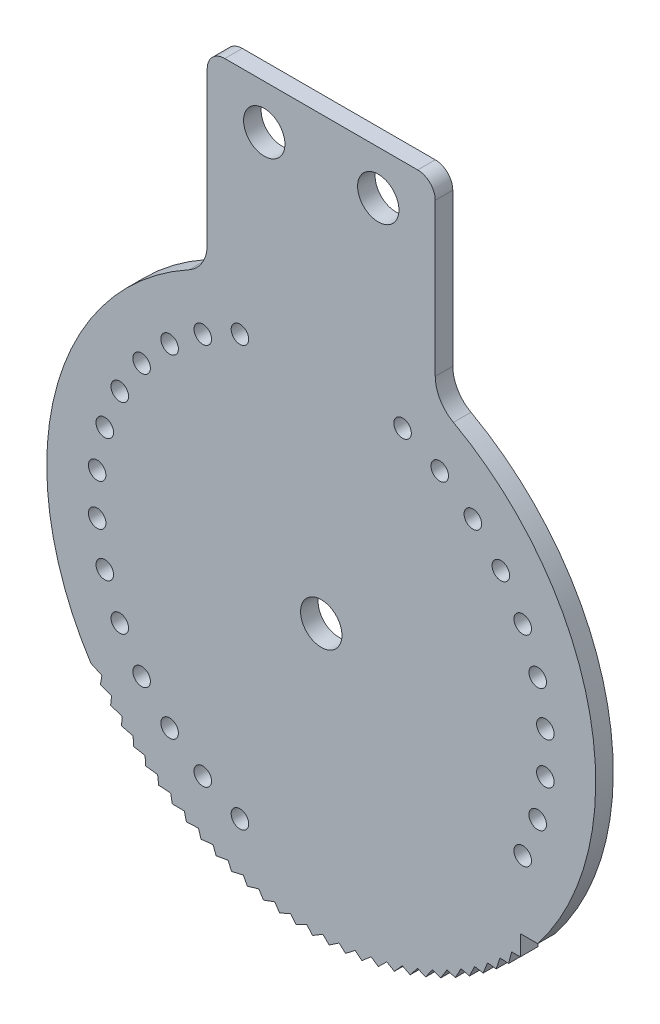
SolidWorks part; units mm, degrees
ref_plane "Front Plane" through (0, 0, 0) normal (0, 0, 1) x (1, 0, 0)
ref_plane "Top Plane" through (0, 0, 0) normal (0, 1, 0) x (1, 0, 0)
ref_plane "Right Plane" through (0, 0, 0) normal (1, 0, 0) x (0, 0, -1)
sketch "Sketch1" plane through (0, 0, 0) normal (0, 0, 1) x (1, 0, 0)
  line L0 (16.8766, 28.4861) -> (16.8766, 50.5569)
  line L1 (-13.589, 53.0969) -> (14.3366, 53.0969)
  line L2 (-21.1851, -44.1428) -> (-19.4455, -44.1554)
  line L3 (-21.1851, -44.1428) -> (-21.4191, -42.9029)
  line L4 (-23.1548, -42.7856) -> (-21.4191, -42.9029)
  line L5 (-23.1548, -42.7856) -> (-23.3139, -41.5339)
  line L6 (-25.0394, -41.3124) -> (-23.3139, -41.5339)
  line L7 (-25.0394, -41.3124) -> (-25.1229, -40.0534)
  line L8 (-26.8319, -39.7285) -> (-25.1229, -40.0534)
  line L9 (-26.8319, -39.7285) -> (-26.8395, -38.4668)
  line L10 (-28.526, -38.0397) -> (-26.8395, -38.4668)
  line L11 (-28.526, -38.0397) -> (-28.4577, -36.7797)
  line L12 (-30.1154, -36.252) -> (-28.4577, -36.7797)
  line L13 (-30.1154, -36.252) -> (-29.9714, -34.9985)
  line L14 (-31.5943, -34.372) -> (-29.9714, -34.9985)
  line L15 (-31.5943, -34.372) -> (-31.3752, -33.1294)
  line L16 (-32.9576, -32.4064) -> (-31.3752, -33.1294)
  line L17 (-19.1373, -45.379) -> (-17.4, -45.287)
  line L18 (-19.1373, -45.379) -> (-19.4455, -44.1554)
  line L19 (-17.0188, -46.4898) -> (-17.4, -45.287)
  line L20 (-17.0188, -46.4898) -> (-15.2902, -46.2935)
  line L21 (-14.8373, -47.4712) -> (-15.2902, -46.2935)
  line L22 (-14.8373, -47.4712) -> (-13.1237, -47.1713)
  line L23 (-12.6008, -48.3197) -> (-13.1237, -47.1713)
  line L24 (-12.6008, -48.3197) -> (-10.9083, -47.9172)
  line L25 (-10.3173, -49.032) -> (-10.9083, -47.9172)
  line L26 (-10.3173, -49.032) -> (-8.6521, -48.5285)
  line L27 (-7.9951, -49.6057) -> (-8.6521, -48.5285)
  line L28 (-7.9951, -49.6057) -> (-6.3632, -49.003)
  line L29 (-5.6425, -50.0387) -> (-6.3632, -49.003)
  line L30 (-5.6425, -50.0387) -> (-4.0498, -49.3389)
  line L31 (-3.2682, -50.3295) -> (-4.0498, -49.3389)
  line L32 (-3.2682, -50.3295) -> (-1.7205, -49.5351)
  line L33 (-0.8807, -50.4769) -> (-1.7205, -49.5351)
  line L34 (-0.8807, -50.4769) -> (0.6164, -49.5909)
  line L35 (1.5113, -50.4804) -> (0.6164, -49.5909)
  line L36 (1.5113, -50.4804) -> (2.9525, -49.5059)
  line L37 (3.8992, -50.34) -> (2.9525, -49.5059)
  line L38 (3.8992, -50.34) -> (5.2792, -49.2807)
  line L39 (6.2744, -50.0563) -> (5.2792, -49.2807)
  line L40 (6.2744, -50.0563) -> (7.5881, -48.9159)
  line L41 (8.6282, -49.6302) -> (7.5881, -48.9159)
  line L42 (8.6282, -49.6302) -> (9.8709, -48.4128)
  line L43 (10.9521, -49.0633) -> (9.8709, -48.4128)
  line L44 (29.1931, -38.1247) -> (27.9313, -38.1247)
  line L45 (29.1931, -38.1287) -> (29.1931, -35.2117)
  line L46 (29.1931, -35.2117) -> (31.7074, -35.2117)
  line L47 (27.4941, -39.8085) -> (27.9313, -38.1247)
  line L48 (27.4941, -39.8085) -> (26.2346, -39.7326)
  line L49 (25.6969, -41.3871) -> (26.2346, -39.7326)
  line L50 (25.6969, -41.3871) -> (24.4442, -41.2356)
  line L51 (23.808, -42.8547) -> (24.4442, -41.2356)
  line L52 (23.808, -42.8547) -> (22.5667, -42.6281)
  line L53 (21.8342, -44.2061) -> (22.5667, -42.6281)
  line L54 (19.7828, -45.4363) -> (20.6088, -43.9053)
  line L55 (21.8342, -44.2061) -> (20.6088, -43.9053)
  line L56 (19.7828, -45.4363) -> (18.5777, -45.0623)
  line L57 (17.661, -46.5409) -> (18.5777, -45.0623)
  line L58 (17.661, -46.5409) -> (16.4806, -46.0951)
  line L59 (15.4767, -47.5159) -> (16.4806, -46.0951)
  line L60 (15.4767, -47.5159) -> (14.3253, -46.9999)
  line L61 (13.2377, -48.3577) -> (12.1194, -47.7734)
  line L62 (13.2377, -48.3577) -> (14.3253, -46.9999)
  line L63 (10.9521, -49.0633) -> (12.1194, -47.7734)
  line L64 (-16.129, 28.4861) -> (-16.129, 50.5569)
  line L65 (0.3738, 28.9463) -> (0.3738, 53.0969) construction
  arc A0 (-32.9576, -32.4064) -> (-18.7623, 24.0342) centre (0.3738, -10.7841) cw
  circle A1 centre (0.3738, -10.745) radius 39.6912 construction
  circle A2 centre (-28.7881, -25.2659) radius 1.27
  circle A3 centre (-25.6234, -30.3771) radius 1.27
  circle A4 centre (-21.5733, -34.8198) radius 1.27
  circle A5 centre (-16.7759, -38.4427) radius 1.27
  circle A6 centre (-11.3945, -41.1223) radius 1.27
  circle A7 centre (29.5357, -25.2659) radius 1.27
  circle A8 centre (31.7074, -19.6602) radius 1.27
  circle A9 centre (32.8121, -13.7508) radius 1.27
  circle A10 centre (32.8121, -7.7391) radius 1.27
  circle A11 centre (31.7074, -1.8298) radius 1.27
  circle A12 centre (29.5357, 3.7759) radius 1.27
  circle A13 centre (26.371, 8.8872) radius 1.27
  circle A14 centre (22.3209, 13.3299) radius 1.27
  circle A15 centre (17.5235, 16.9527) radius 1.27
  circle A16 centre (12.142, 19.6324) radius 1.27
  circle A17 centre (-11.3945, 19.6324) radius 1.27
  circle A18 centre (-16.7759, 16.9527) radius 1.27
  circle A19 centre (-21.5733, 13.3299) radius 1.27
  circle A20 centre (-25.6234, 8.8872) radius 1.27
  circle A21 centre (-28.7881, 3.7759) radius 1.27
  circle A22 centre (-30.9598, -1.8298) radius 1.27
  circle A23 centre (-32.0645, -7.7391) radius 1.27
  circle A24 centre (-32.0645, -13.7508) radius 1.27
  circle A25 centre (-30.9598, -19.6602) radius 1.27
  circle A26 centre (0.3738, -10.745) radius 2.9925
  arc A27 (19.5099, 24.0342) -> (31.7074, -35.2117) centre (0.3738, -10.7841) cw
  circle A28 centre (-7.8776, 46.7085) radius 2.9925
  circle A30 centre (8.6252, 46.7085) radius 2.9925
  arc A31 (19.5099, 24.0342) -> (16.8766, 28.4861) centre (21.9566, 28.4861) cw
  arc A32 (-18.7623, 24.0342) -> (-16.129, 28.4861) centre (-21.209, 28.4861) ccw
  arc A33 (-13.589, 53.0969) -> (-16.129, 50.5569) centre (-13.589, 50.5569) ccw
  arc A34 (14.3366, 53.0969) -> (16.8766, 50.5569) centre (14.3366, 50.5569) cw
  dimension "D1" = 5.08
  dimension "D2" = 2.54
extrude "Boss-Extrude1" add sketch "Sketch1" along normal blind 2.54 contours A34 L1 A33 L64 A32 A0 L16 L15 L14 L13 L12 L11 L10 L9 L8 L7 L6 L5 L4 L3 L2 L18 L17 L19 L20 L21 L22 L23 L24 L25 L26 L27 L28 L29 L30 L31 L32 L33 L34 L35 L36 L37 L38 L39 L40 L41 L42 L43 L63 L61 L62
